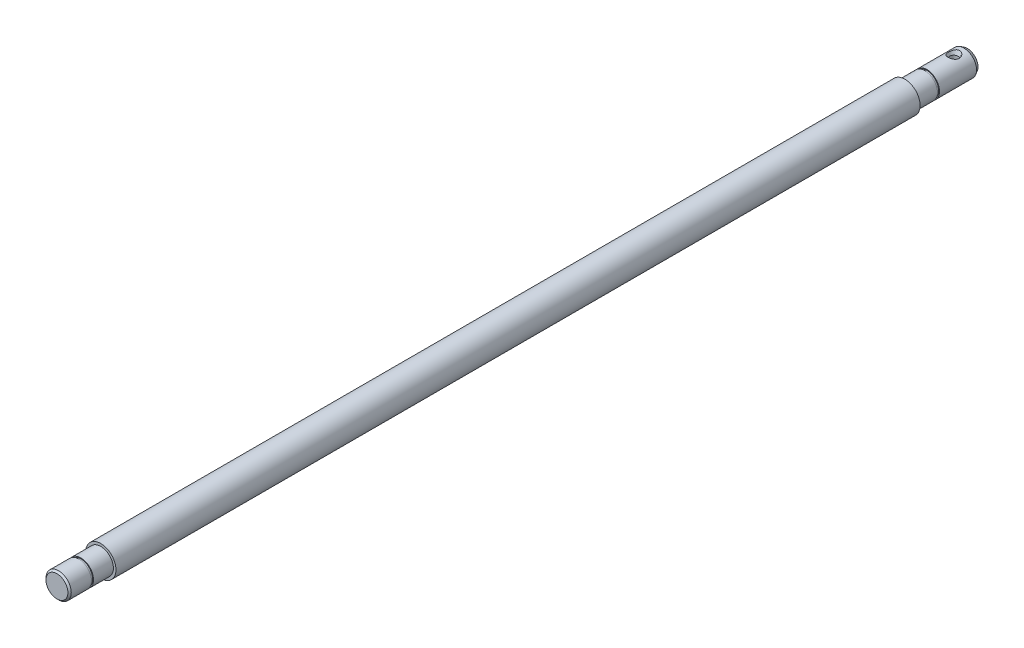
SolidWorks part; units mm, degrees
ref_plane "Plan de face" through (0, 0, 0) normal (0, 0, 1) x (1, 0, 0)
ref_plane "Plan de dessus" through (0, 0, 0) normal (0, 1, 0) x (1, 0, 0)
ref_plane "Plan de droite" through (0, 0, 0) normal (1, 0, 0) x (0, 0, -1)
sketch "Esquisse1" plane through (0, 0, 0) normal (0, 0, 1) x (1, 0, 0)
  circle A0 centre (0, 0) radius 7.5
  dimension "D1" = 15
extrude "Extrusion1" add sketch "Esquisse1" along normal blind 540
ref_plane "Plan2" through (0, 0, 37) normal (0, 0, -1) x (-1, 0, 0)
ref_plane "Plan1" through (0, 7.5, 0) normal (0, 1, 0) x (-1, 0, 0)
chamfer "Chanfrein1" distance 2 angle 30 1 edges at (7.5, 0, 0)
hole_wizard "Trou taraudé M61" positions "Esquisse3" profile "Esquisse2" tap size "M6" standard "ISO"
sketch "Esquisse3" plane through (-8.2491, 7.5, -28.8697) normal (0, 1, 0) x (1, 0, 0)
  line L0 (8.2491, -28.8697) -> (8.2491, -38.1075) construction
  line L3 (14.5944, -28.8697) -> (1.9038, -28.8697) construction
  point P0 (8.2491, -36.8697)
  dimension "D1" = 8
sketch "Esquisse2" plane through (0, 7.5, 8) normal (1, 0, 0) x (0, 0, 1)
  line L0 (0, 0) -> (0, 15)
  line L1 (0, 15) -> (3.5, 15)
  line L2 (2.5, 12.5858) -> (2.5, 2.4142)
  line L3 (2.5, 2.4142) -> (3.5, 0)
  line L5 (3.5, 0) -> (0, 0)
  line L6 (-2.5, 2.4142) -> (-3.5, 0) construction
  line L7 (3.5, 15) -> (2.5, 12.5858)
  line L8 (-3.5, 15) -> (-2.5, 12.5858) construction
  line L11 (0, -6.35) -> (0, 107.95) construction
  dimension "Diamètre du trou pour taraudage jusqu'au prochain" = 5
  dimension "Profondeur du trou pour taraudage jusqu'au prochain" = 15
  dimension "Diamètre du fraisage entrant" = 7
  dimension "Angle du fraisage entrant" = 45
  dimension "Diamètre du fraisage débouchant" = 7
  dimension "Angle du fraisage débouchant" = 45
ref_plane "Plan4" through (0, 0, 514) normal (0, 0, 1) x (1, 0, 0)
sketch "Esquisse4" plane through (0, 0, 0) normal (0, 1, 0) x (1, 0, 0)
  line L0 (7.5, -540) -> (7.5, -2) construction
  line L1 (7.5, -24) -> (7, -24)
  line L2 (7.5, -24) -> (7.5, -25.2)
  line L3 (7.5, -25.2) -> (7, -25.2)
  line L4 (7, -24) -> (7, -25.2)
  line L5 (0, 0) -> (0, -24.5329) construction
  line L6 (6.3453, 0) -> (-6.3453, 0) construction
  dimension "D1" = 24
  dimension "D2" = 1.2
  dimension "D3" = 0.5
revolve "Enlèvement de matière-Révolution1" cut sketch "Esquisse4" angle 360 about L5
sketch "Esquisse5" plane through (0, 0, 514) normal (0, 0, 1) x (1, 0, 0)
  circle A2 centre (0, 0) radius 9
  circle A3 centre (0, 0) radius 9
  dimension "D1" = 1.5
extrude "Extrusion2" add sketch "Esquisse5" against normal up to surface (477 mm away)
sketch "Esquisse6" plane through (0, 0, 0) normal (0, 1, 0) x (1, 0, 0)
  line L0 (7.5, -540) -> (7.5, -514) construction
  line L1 (7.5, -525.8) -> (7, -525.8)
  line L2 (7.5, -525.8) -> (7.5, -527)
  line L3 (7.5, -527) -> (7, -527)
  line L4 (7, -525.8) -> (7, -527)
  line L5 (-9, -514) -> (9, -514) construction
  line L6 (0, -539.8555) -> (0, -517.3361) construction
  dimension "D1" = 1.2
  dimension "D2" = 0.5
  dimension "D3" = 11.8
revolve "Enlèvement de matière-Révolution2" cut sketch "Esquisse6" angle 360 about L6
chamfer "Chanfrein2" distance 1 angle 45 1 edges at (7.5, 0, 540)
